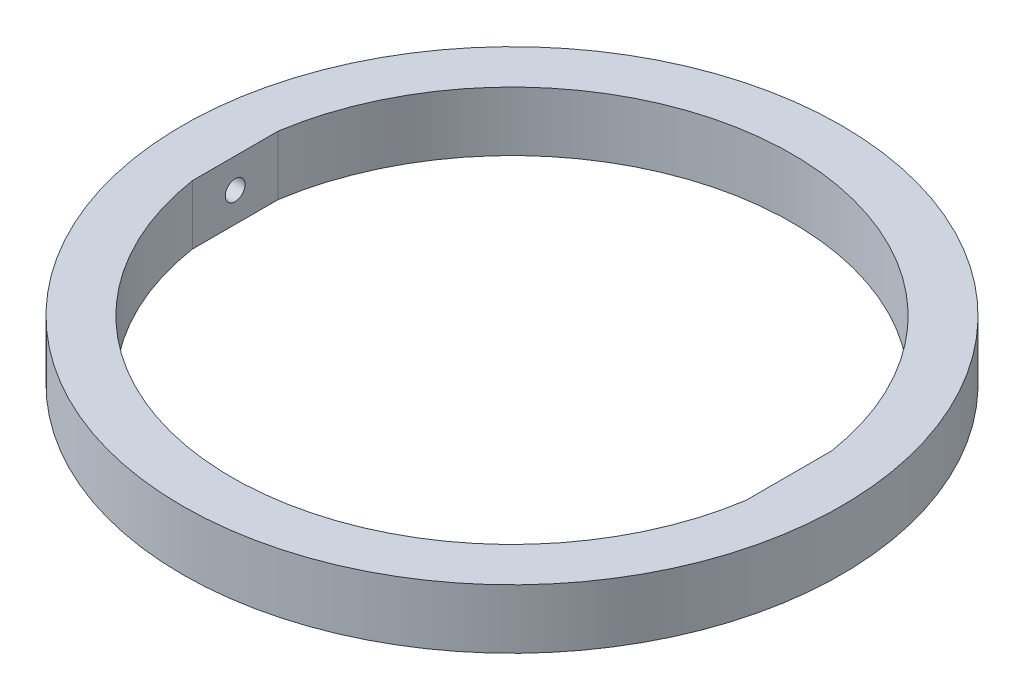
SolidWorks part; units mm, degrees
ref_plane "Front Plane" through (0, 0, 0) normal (0, 0, 1) x (1, 0, 0)
ref_plane "Top Plane" through (0, 0, 0) normal (0, 1, 0) x (1, 0, 0)
ref_plane "Right Plane" through (0, 0, 0) normal (1, 0, 0) x (0, 0, -1)
sketch "Sketch1" plane through (0, 0, 0) normal (0, 1, 0) x (1, 0, 0)
  circle A0 centre (0, 0) radius 42.5
  circle A1 centre (0, 0) radius 50
  dimension "D1" = 85
  dimension "D2" = 100
extrude "Boss-Extrude1" add sketch "Sketch1" along normal blind 9
sketch "Sketch2" plane through (0, 9, 0) normal (0, 1, 0) x (1, 0, 0)
  line L1 (42, -6.5) -> (-42, -6.5)
  line L2 (42, -6.5) -> (42, 6.5)
  line L3 (42, 6.5) -> (-42, 6.5)
  line L4 (-42, -6.5) -> (-42, 6.5)
  line L5 (42, -6.5) -> (-42, 6.5) construction
  line L6 (42, 6.5) -> (-42, -6.5) construction
  circle A0 centre (0, 0) radius 42.5
  circle A1 centre (0, 0) radius 42.5 construction
  dimension "D2" = 0
  dimension "D1" = 84
extrude "Boss-Extrude2" add sketch "Sketch2" against normal blind 9 contours L4 M6 | L2 M6
sketch "Sketch3" plane through (-42, 0, 0) normal (1, 0, 0) x (0, 0, -1)
  line L0 (-6.5, 0) -> (6.5, 0) construction
  circle A0 centre (0, 4.5) radius 1.5
  dimension "D1" = 3
  dimension "D2" = 4.5
extrude "Cut-Extrude1" cut sketch "Sketch3" against normal blind 5 and the other way blind 89
